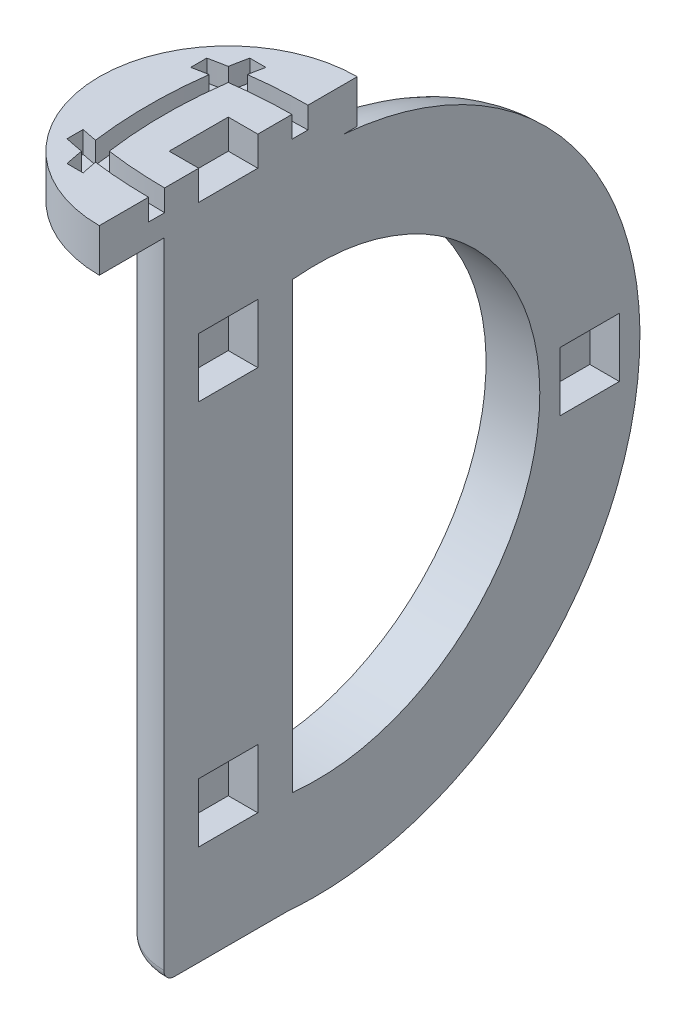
SolidWorks part; units mm, degrees
ref_plane "Front Plane" through (0, 0, 0) normal (0, 0, 1) x (1, 0, 0)
ref_plane "Top Plane" through (0, 0, 0) normal (0, 1, 0) x (1, 0, 0)
ref_plane "Right Plane" through (0, 0, 0) normal (1, 0, 0) x (0, 0, -1)
sketch "Sketch1" plane through (0, 0, 0) normal (0, 1, 0) x (1, 0, 0)
  circle A0 centre (0, 0) radius 24
  dimension "D1" = 48
extrude "Boss-Extrude1" add sketch "Sketch1" along normal blind 8
sketch "Sketch3" plane through (0, 8, 0) normal (0, 1, 0) x (1, 0, 0)
  line L0 (-5.5, 5.5) -> (5.5, 5.5)
  line L1 (5.5, 5.5) -> (5.5, -5.5)
  line L2 (5.5, -5.5) -> (-5.5, -5.5)
  line L3 (-5.5, -5.5) -> (-5.5, 5.5)
  dimension "D1" = 11
  dimension "D2" = 5.5
  dimension "D3" = 11
  dimension "D4" = 5.5
extrude "Cut-Extrude2" cut sketch "Sketch3" against normal blind 5.5
sketch "Sketch10" plane through (0, 8, 0) normal (0, 1, 0) x (1, 0, 0)
  line L1 (-17, 13) -> (-17, 10)
  line L3 (17, 10) -> (17, 13)
  line L4 (10, -17) -> (13, -17)
  line L5 (13, 17) -> (10, 17)
  line L7 (-17, -10) -> (-17, -13)
  line L8 (17, -13) -> (17, -10)
  line L10 (-10, 17) -> (-13, 17)
  line L11 (-13, -17) -> (-10, -17)
  arc A0 (-17, 13) -> (-13.6534, 13.6534) centre (0, -65.1729) cw
  arc A1 (-17, 10) -> (-14.125, 10.5759) centre (0, -67.4053) cw
  arc A2 (10, 17) -> (10.5759, 14.125) centre (-67.4053, 0) cw
  arc A3 (13, 17) -> (13.6534, 13.6534) centre (-65.1729, 0) cw
  arc A4 (17, -10) -> (14.125, -10.5759) centre (0, 67.4053) cw
  arc A5 (17, -13) -> (13.6534, -13.6534) centre (0, 65.1729) cw
  arc A6 (-10, -17) -> (-10.5759, -14.125) centre (67.4053, 0) cw
  arc A7 (-13, -17) -> (-13.6534, -13.6534) centre (65.1729, 0) cw
  arc A8 (-10.5759, 14.125) -> (-10, 17) centre (67.4053, 0) cw
  arc A9 (-13.6534, 13.6534) -> (-13, 17) centre (65.1729, 0) cw
  arc A10 (-11.0681, 11.0681) -> (11.0681, 11.0681) centre (0, -67.4053) cw
  arc A11 (-10.5759, 14.125) -> (10.5759, 14.125) centre (0, -65.1729) cw
  arc A12 (13.6534, 13.6534) -> (17, 13) centre (0, -65.1729) cw
  arc A13 (14.125, 10.5759) -> (17, 10) centre (0, -67.4053) cw
  arc A14 (11.0681, 11.0681) -> (11.0681, -11.0681) centre (-67.4053, 0) cw
  arc A15 (14.125, 10.5759) -> (14.125, -10.5759) centre (-65.1729, 0) cw
  arc A16 (13.6534, -13.6534) -> (13, -17) centre (-65.1729, 0) cw
  arc A17 (10.5759, -14.125) -> (10, -17) centre (-67.4053, 0) cw
  arc A18 (11.0681, -11.0681) -> (-11.0681, -11.0681) centre (0, 67.4053) cw
  arc A19 (10.5759, -14.125) -> (-10.5759, -14.125) centre (0, 65.1729) cw
  arc A20 (-13.6534, -13.6534) -> (-17, -13) centre (0, 65.1729) cw
  arc A21 (-14.125, -10.5759) -> (-14.125, 10.5759) centre (65.1729, 0) cw
  arc A22 (-14.125, -10.5759) -> (-17, -10) centre (0, 67.4053) cw
  arc A23 (-11.0681, -11.0681) -> (-11.0681, 11.0681) centre (67.4053, 0) cw
  point P36 (0, 0)
extrude "Cut-Extrude6" cut sketch "Sketch10" against normal blind 4
sketch "Sketch12" plane through (0, 0, 0) normal (0, 0, 1) x (1, 0, 0)
  line L0 (0, 0) -> (0, -120)
  line L1 (0, -120) -> (12, -120)
  line L2 (12, -120) -> (12, 0)
  line L3 (-24, 0) -> (24, 0) construction
  line L4 (12, 0) -> (0, 0)
  line L5 (0, 0) -> (0.3914, 0.2819)
  dimension "D1" = 12
  dimension "D2" = 120
revolve "Revolve4" add sketch "Sketch12" angle 360 about L0
sketch "Sketch13" plane through (0, 0, 0) normal (0, 0, 1) x (1, 0, 0)
  line L0 (-10, -18.6332) -> (10, -18.6332)
  arc A0 (10, -18.6332) -> (-10, -18.6332) centre (0, -12) ccw
  dimension "D1" = 24
  dimension "D2" = 20
sketch "Sketch14" plane through (0, 0, 0) normal (1, 0, 0) x (0, 0, -1)
  line L2 (0, -108) -> (12, -108)
  line L3 (0, -12) -> (12, -12)
  arc A0 (12, -108) -> (12, -12) centre (16.4021, -60) ccw
  dimension "D2" = 12
  dimension "D3" = 12
sweep "Sweep1" add profiles "Sketch13" path "Sketch14"
sketch "Sketch15" plane through (0, -120, 0) normal (0, -1, 0) x (1, 0, 0)
  line L0 (0, 0) -> (0, -90.1747)
  line L1 (0, -90.1747) -> (36.7511, -90.1747)
  line L2 (36.7511, -90.1747) -> (36.7511, 36.1347)
  line L3 (36.7511, 36.1347) -> (0, 36.1347)
  line L4 (0, 36.1347) -> (0, 0)
extrude "Cut-Extrude7" cut sketch "Sketch15" against normal through all
sketch "Sketch16" plane through (0, 0, 0) normal (1, 0, 0) x (0, 0, -1)
  line L5 (5.5, -101.3668) -> (-5.5, -101.3668)
  line L6 (5.5, -18.6332) -> (-5.5, -18.6332)
  line L8 (61.7703, -54.5) -> (61.7703, -65.5)
  line L9 (61.7703, -65.5) -> (72.7703, -65.5)
  line L10 (72.7703, -65.5) -> (72.7703, -54.5)
  line L11 (72.7703, -54.5) -> (61.7703, -54.5)
  line L12 (-5.5, -18.6332) -> (-5.5, -29.6332)
  line L13 (-5.5, -29.6332) -> (5.5, -29.6332)
  line L14 (5.5, -29.6332) -> (5.5, -18.6332)
  line L15 (-5.5, -101.3668) -> (-5.5, -90.3668)
  line L16 (-5.5, -90.3668) -> (5.5, -90.3668)
  line L17 (5.5, -90.3668) -> (5.5, -101.3668)
  dimension "D1" = 11
  dimension "D2" = 11
  dimension "D4" = 11
  dimension "D5" = 11
  dimension "D6" = 11
  dimension "D7" = 11
extrude "Cut-Extrude8" cut sketch "Sketch16" against normal blind 5.5
sketch "Sketch17" plane through (0, -120, 0) normal (0, 1, 0) x (1, 0, 0)
  line L0 (0, 21.3994) -> (0, 11.4509)
  line L1 (0, 11.4509) -> (4.8372, 11.4509)
  line L2 (4.8372, 11.4509) -> (4.8372, 21.3994)
  line L3 (4.8372, 21.3994) -> (0, 21.3994)
extrude "Cut-Extrude9" cut sketch "Sketch17" against normal blind 10
fillet "Fillet1" radius 2 1 edges at (-11.9891, -120, 0.5119)
equation "\"D2@Sketch10\"=\"D1@Sketch10\"/2"
